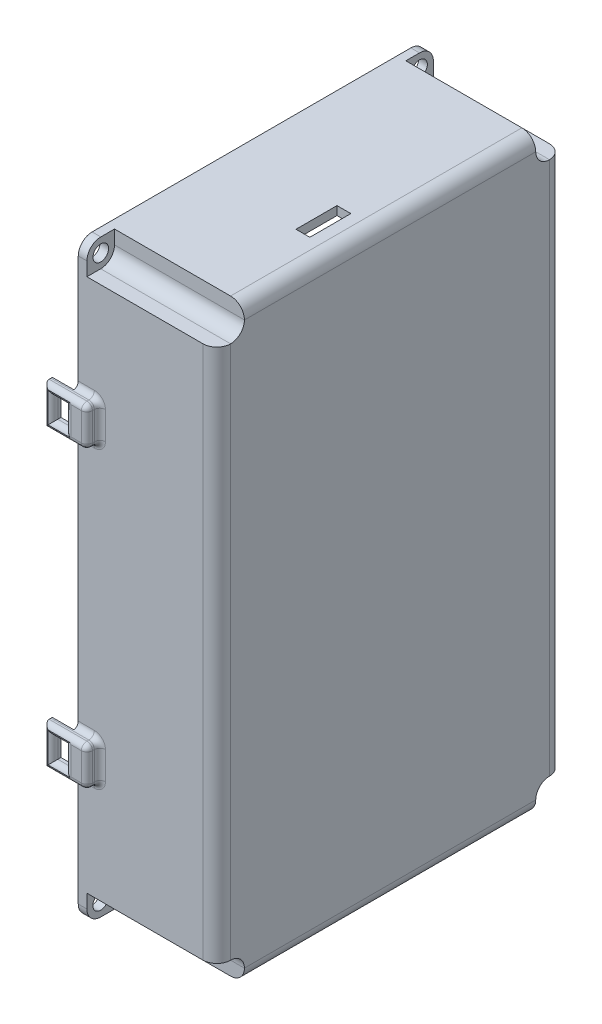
SolidWorks part; units mm, degrees
ref_plane "Front Plane" through (0, 0, 0) normal (0, 0, 1) x (1, 0, 0)
ref_plane "Top Plane" through (0, 0, 0) normal (0, 1, 0) x (1, 0, 0)
ref_plane "Right Plane" through (0, 0, 0) normal (1, 0, 0) x (0, 0, -1)
sketch "Sketch1" plane through (0, 0, 0) normal (1, 0, 0) x (0, 0, -1)
  line L1 (-31.75, -53.975) -> (31.75, -53.975)
  line L2 (-31.75, -53.975) -> (-31.75, 53.975)
  line L3 (-31.75, 53.975) -> (31.75, 53.975)
  line L4 (31.75, -53.975) -> (31.75, 53.975)
  line L5 (-31.75, -53.975) -> (31.75, 53.975) construction
  line L6 (-31.75, 53.975) -> (31.75, -53.975) construction
  point P0 (0, 0)
  dimension "D1" = 63.5
  dimension "D2" = 107.95
extrude "Boss-Extrude1" add sketch "Sketch1" along normal mid plane 25.4
shell "Shell1" thickness 1.5875
sketch "Sketch2" plane through (0, 0, 31.75) normal (0, 0, 1) x (1, 0, 0)
  line L0 (-12.7, 53.975) -> (-12.7, -53.975) construction
  line L1 (-16.6688, 23.4156) -> (-8.7313, 23.4156)
  line L2 (-16.6688, 23.4156) -> (-16.6688, 30.5594)
  line L3 (-16.6688, 30.5594) -> (-8.7313, 30.5594)
  line L4 (-8.7313, 23.4156) -> (-8.7313, 30.5594)
  line L5 (-16.6688, 23.4156) -> (-8.7313, 30.5594) construction
  line L6 (-16.6688, 30.5594) -> (-8.7313, 23.4156) construction
  line L7 (-12.7, 0) -> (12.7, 0) construction
  line L8 (12.7, 53.975) -> (12.7, -53.975) construction
  line L9 (-12.7, 53.975) -> (-12.7, 0) construction
  line L11 (-12.7, 25.0031) -> (-15.0813, 25.0031)
  line L12 (-12.7, 25.0031) -> (-12.7, 28.9719)
  line L13 (-12.7, 28.9719) -> (-15.0813, 28.9719)
  line L14 (-15.0813, 25.0031) -> (-15.0813, 28.9719)
  line L15 (-12.7, 25.0031) -> (-15.0813, 28.9719) construction
  line L16 (-12.7, 28.9719) -> (-15.0813, 25.0031) construction
  point P0 (-12.7, 26.9875)
  point P14 (-12.7, 26.9875)
  point P15 (-16.6688, 26.9875)
  point P16 (-13.8906, 26.9875)
  dimension "D1" = 7.1437
  dimension "D2" = 3.9688
  dimension "D3" = 1.5875
  dimension "D4" = 1.5875
extrude "Boss-Extrude2" add sketch "Sketch2" along normal blind 2.3812
mirror "Mirror1" about plane through (0, 0, 0) normal (0, 1, 0) of "Boss-Extrude2"
mirror "Mirror2" about plane through (0, 0, 0) normal (0, 0, 1) of "Mirror1", "Boss-Extrude2"
sketch "Sketch3" plane through (0, -53.975, 0) normal (0, -1, 0) x (1, 0, 0)
  line L0 (-12.7, 31.75) -> (-12.7, -31.75) construction
  line L1 (-12.7, 15.875) -> (-2.6605, 15.875)
  line L2 (-12.7, 15.875) -> (-12.7, -15.875)
  line L3 (-12.7, -15.875) -> (-2.6605, -15.875)
  line L4 (-2.6605, 15.875) -> (-2.6605, -15.875)
  point P6 (-2.6605, 0)
  dimension "D1" = 31.75
extrude "Cut-Extrude1" cut sketch "Sketch3" against normal blind 3.175
sketch "Sketch4" plane through (-16.6688, 0, 0) normal (-1, 0, 0) x (0, 0, 1)
  line L0 (34.1313, 23.4156) -> (31.75, 23.4156) construction
  line L1 (31.75, 30.5594) -> (32.5438, 30.5594)
  line L2 (31.75, 30.5594) -> (31.75, 23.4156)
  line L3 (31.75, 23.4156) -> (32.5438, 23.4156)
  line L4 (32.5438, 30.5594) -> (32.5438, 23.4156)
  dimension "D1" = 0.7937
extrude "Cut-Extrude2" cut sketch "Sketch4" against normal up to surface (3.9688 mm away)
mirror "Mirror3" about plane through (0, 0, 0) normal (0, 0, 1) of "Cut-Extrude2"
mirror "Mirror4" about plane through (0, 0, 0) normal (0, 1, 0) of "Mirror3", "Cut-Extrude2"
fillet "Fillet1" radius 2.54 7 edges at (12.7, -53.975, 0) (12.7, 0, 31.75) (12.7, 53.975, 0) (12.7, 0, -31.75) (-7.6803, -53.975, -15.875) (-7.6803, -53.975, 15.875) (-2.6605, -53.975, 0)
fillet "Fillet4" radius 1.016 52 edges at (-10.7156, 23.4156, 31.75) (-10.7156, 30.5594, 31.75) (-10.7156, -30.5594, 31.75) (-10.7156, -23.4156, 31.75) (-10.7156, -23.4156, -31.75) (-10.7156, -30.5594, -31.75) (-10.7156, 30.5594, -31.75) (-10.7156, 23.4156, -31.75) (-13.8906, 25.0031, 34.1313) (-12.7, 26.9875, 34.1313) (-13.8906, 28.9719, 34.1313) (-15.0813, 26.9875, 34.1313) (-12.7, 23.4156, 34.1313) (-16.6688, 26.9875, 34.1313) (-12.7, 30.5594, 34.1313) (-8.7313, 23.4156, 32.9406) (-8.7313, 26.9875, 34.1313) (-8.7313, 30.5594, 32.9406) (-8.7313, 26.9875, 31.75) (-12.7, -30.5594, 34.1313) (-16.6688, -26.9875, 34.1313) (-12.7, -23.4156, 34.1313) (-15.0813, -26.9875, 34.1313) (-12.7, -26.9875, 34.1313) (-13.8906, -25.0031, 34.1313) (-13.8906, -28.9719, 34.1313) (-8.7313, -30.5594, 32.9406) (-8.7313, -26.9875, 34.1313) (-8.7313, -23.4156, 32.9406) (-8.7313, -26.9875, 31.75) (-13.8906, -25.0031, -34.1313) (-15.0813, -26.9875, -34.1313) (-12.7, -26.9875, -34.1313) (-13.8906, -28.9719, -34.1313) (-12.7, -23.4156, -34.1313) (-16.6688, -26.9875, -34.1313) (-12.7, -30.5594, -34.1313) (-8.7313, -23.4156, -32.9406) (-8.7313, -26.9875, -34.1313) (-8.7313, -30.5594, -32.9406) (-8.7313, -26.9875, -31.75) (-12.7, 30.5594, -34.1313) (-16.6688, 26.9875, -34.1313) (-12.7, 23.4156, -34.1313) (-15.0813, 26.9875, -34.1313) (-12.7, 26.9875, -34.1313) (-13.8906, 25.0031, -34.1313) (-13.8906, 28.9719, -34.1313) (-8.7313, 30.5594, -32.9406) (-8.7313, 26.9875, -34.1313) (-8.7313, 23.4156, -32.9406) (-8.7313, 26.9875, -31.75)
sketch "Sketch7" plane through (11.1125, 0, 0) normal (-1, 0, 0) x (0, 0, 1)
  line L1 (-30.1625, 52.3875) -> (30.1625, 52.3875) construction
  line L2 (-30.1625, -52.3875) -> (-30.1625, 52.3875) construction
  circle A0 centre (-13.5636, 46.0375) radius 2.3812
  circle A1 centre (13.5636, 46.0375) radius 2.3812
  circle A2 centre (-13.5636, 46.0375) radius 1.4351
  circle A3 centre (13.5636, 46.0375) radius 1.4351
  dimension "D1" = 4.7625
  dimension "D6" = 2.8702
  dimension "D2" = 6.35
  dimension "D3" = 16.5989
  dimension "D4" = 43.7261
  dimension "D5" = 6.35
extrude "Boss-Extrude4" add sketch "Sketch7" along normal blind 5.588
sketch "Sketch8" plane through (0, 53.975, 0) normal (0, 1, 0) x (1, 0, 0)
  line L1 (5.5626, -2.5908) -> (8.1026, -2.5908)
  line L2 (5.5626, -2.5908) -> (5.5626, -10.1092)
  line L3 (5.5626, -10.1092) -> (8.1026, -10.1092)
  line L4 (8.1026, -2.5908) -> (8.1026, -10.1092)
  line L5 (8.1026, -10.1092) -> (5.5626, -2.5908) construction
  line L6 (5.5626, -10.1092) -> (8.1026, -2.5908) construction
  line L10 (10.16, -31.75) -> (10.16, 31.75) construction
  line L11 (10.16, 31.75) -> (-12.7, 31.75) construction
  point P0 (6.8326, -6.35)
  point P5 (0, 0)
  dimension "D1" = 7.5184
  dimension "D2" = 2.54
  dimension "D3" = 38.1
  dimension "D4" = 3.3274
extrude "Cut-Extrude3" cut sketch "Sketch8" against normal blind 5.08
sketch "Sketch9" plane through (11.1125, 0, 0) normal (-1, 0, 0) x (0, 0, 1)
  line L0 (25.8636, -40.9575) -> (27.4511, -40.9575)
  line L1 (25.8636, 4.7625) -> (27.4511, 4.7625)
  line L2 (25.8636, 4.7625) -> (25.8636, 1.5875)
  line L3 (25.8636, 1.5875) -> (27.4511, 1.5875)
  line L4 (27.4511, 4.7625) -> (27.4511, 1.5875)
  line L5 (25.8636, 4.7625) -> (27.4511, 1.5875) construction
  line L6 (25.8636, 1.5875) -> (27.4511, 4.7625) construction
  line L11 (25.8636, -40.9575) -> (25.8636, -44.1325)
  line L12 (25.8636, -44.1325) -> (27.4511, -44.1325)
  line L17 (27.4511, -40.9575) -> (27.4511, -44.1325)
  line L18 (25.8636, -40.9575) -> (27.4511, -44.1325) construction
  line L23 (25.8636, -44.1325) -> (27.4511, -40.9575) construction
  line L24 (-27.451, -40.9575) -> (-25.8635, -40.9575)
  line L25 (-27.451, -40.9575) -> (-27.451, -44.1325)
  line L26 (-27.451, -44.1325) -> (-25.8635, -44.1325)
  line L27 (-25.8635, -40.9575) -> (-25.8635, -44.1325)
  line L28 (-27.451, -40.9575) -> (-25.8635, -44.1325) construction
  line L29 (-27.451, -44.1325) -> (-25.8635, -40.9575) construction
  line L30 (-27.4511, 4.7625) -> (-25.8636, 4.7625)
  line L31 (-27.4511, 4.7625) -> (-27.4511, 1.5875)
  line L32 (-27.4511, 1.5875) -> (-25.8636, 1.5875)
  line L33 (-25.8636, 4.7625) -> (-25.8636, 1.5875)
  line L34 (-27.4511, 4.7625) -> (-25.8636, 1.5875) construction
  line L35 (-27.4511, 1.5875) -> (-25.8636, 4.7625) construction
  line L36 (25.8636, -18.0975) -> (27.4511, -18.0975)
  line L37 (25.8636, -18.0975) -> (25.8636, -21.2725)
  line L38 (25.8636, -21.2725) -> (27.4511, -21.2725)
  line L39 (27.4511, -18.0975) -> (27.4511, -21.2725)
  line L40 (25.8636, -18.0975) -> (27.4511, -21.2725) construction
  line L41 (25.8636, -21.2725) -> (27.4511, -18.0975) construction
  line L42 (-27.4511, -18.0975) -> (-25.8636, -18.0975)
  line L43 (-27.4511, -18.0975) -> (-27.4511, -21.2725)
  line L44 (-27.4511, -21.2725) -> (-25.8636, -21.2725)
  line L45 (-25.8636, -18.0975) -> (-25.8636, -21.2725)
  line L46 (-27.4511, -18.0975) -> (-25.8636, -21.2725) construction
  line L47 (-27.4511, -21.2725) -> (-25.8636, -18.0975) construction
  line L48 (26.6573, 3.175) -> (-26.6573, 3.175) construction
  line L54 (-30.1625, -52.3875) -> (-30.1625, 52.3875) construction
  line L55 (-30.1625, 52.3875) -> (30.1625, 52.3875) construction
  point P0 (26.6573, 3.175)
  point P6 (26.6573, -42.545)
  point P11 (-26.6573, -42.545)
  point P16 (-26.6573, 3.175)
  point P21 (26.6573, -19.685)
  point P26 (-26.6573, -19.685)
  point P32 (0, 3.175)
  point P33 (0, 0)
  dimension "D1" = 3.175
  dimension "D2" = 1.5875
  dimension "D3" = 53.3146
  dimension "D4" = 22.86
  dimension "D5" = 22.86
  dimension "D6" = 30.1625
  dimension "D7" = 49.2125
extrude "Boss-Extrude5" add sketch "Sketch9" along normal blind 8.1216
sketch "Sketch10" plane through (0, 0, 25.8636) normal (0, 0, -1) x (-1, 0, 0)
  line L1 (-2.9908, -18.0975) -> (-4.5784, -18.0975)
  line L2 (-2.9908, -18.0975) -> (-2.9908, -21.2725)
  line L3 (-2.9908, -21.2725) -> (-4.5784, -21.2725)
  line L4 (-4.5784, -18.0975) -> (-4.5784, -21.2725)
  point P5 (7.2438, -4.8779)
  point P6 (-2.9908, -24.4475)
  point P7 (-2.9908, -21.2725)
  dimension "D1" = 1.5875
extrude "Boss-Extrude6" add sketch "Sketch10" along normal blind 1.5875
ref_plane "Plane1" through (0, -8.255, 0) normal (0, 1, 0) x (1, 0, 0)
ref_plane "Plane2" through (0, -31.115, 0) normal (0, -1, 0) x (-1, 0, 0)
mirror "Mirror5" about plane through (0, -8.255, 0) normal (0, 1, 0) of "Boss-Extrude6"
mirror "Mirror6" about plane through (0, -31.115, 0) normal (0, -1, 0) of "Mirror5"
mirror "Mirror7" about plane through (0, 0, 0) normal (0, 0, 1) of "Mirror6", "Boss-Extrude6", "Mirror5"
fillet "Fillet6" radius 1.5875 6 edges at (2.9908, 3.175, -24.2761) (2.9908, -19.685, -24.2761) (2.9908, -42.545, -24.2761) (2.9908, -42.545, 24.2761) (2.9908, -19.685, 24.2761) (2.9908, 3.175, 24.2761)
fillet "Fillet7" radius 1.5875 18 edges at (11.1125, 1.5875, -26.6573) (11.1125, 3.175, -27.4511) (11.1125, 4.7625, -26.6573) (11.1125, 4.7625, 26.6573) (11.1125, 1.5875, 26.6573) (11.1125, -21.2725, 26.6573) (11.1125, -18.0975, 26.6573) (11.1125, -40.9575, 26.6573) (11.1125, -44.1325, 26.6573) (11.1125, -44.1325, -26.6573) (11.1125, -40.9575, -26.6573) (11.1125, -21.2725, -26.6573) (11.1125, -18.0975, -26.6573) (11.1125, -19.685, -27.4511) (11.1125, -42.545, -27.451) (11.1125, -42.545, 27.4511) (11.1125, -19.685, 27.4511) (11.1125, 3.175, 27.4511)
sketch "Sketch13" plane through (-12.7, 0, 0) normal (-1, 0, 0) x (0, 0, 1)
  line L0 (-31.75, 53.975) -> (31.75, 53.975) construction
  line L1 (31.75, 53.975) -> (31.75, 31.5754) construction
  line L2 (-31.75, 31.5754) -> (-31.75, 53.975) construction
  line L5 (-31.75, -53.975) -> (-31.75, -31.5754) construction
  line L6 (-18.2296, -53.975) -> (-31.75, -53.975) construction
  line L7 (31.75, -31.5754) -> (31.75, -53.975) construction
  line L8 (31.75, -53.975) -> (18.2296, -53.975) construction
  circle A0 centre (28.429, 50.6539) radius 3.3211
  circle A1 centre (-28.429, 50.6539) radius 3.3211
  circle A2 centre (-28.429, -50.6539) radius 3.3211
  circle A3 centre (28.429, -50.6539) radius 3.3211
  point P8 (23.6891, 46.4053)
  point P17 (-12.2369, -32.5298)
  point P20 (12.2822, -34.3326)
  dimension "D1" = 6.6421
extrude "Boss-Extrude7" add sketch "Sketch13" against normal up to surface (23.8125 mm away)
sketch "Sketch14" plane through (12.7, 0, 0) normal (1, 0, 0) x (0, 0, -1)
  line L0 (26.6954, -51.4477) -> (26.6954, -53.975)
  line L1 (31.75, 50.6539) -> (31.75, -50.6539) construction
  line L2 (-28.429, 53.975) -> (28.429, 53.975) construction
  line L3 (-31.75, -50.6539) -> (-31.75, 50.6539) construction
  line L4 (28.429, -53.975) -> (-28.429, -53.975) construction
  line L13 (-26.6954, 51.4477) -> (-26.6954, 53.975)
  line L14 (-26.6954, 53.975) -> (-31.75, 53.975)
  line L15 (-31.75, 53.975) -> (-31.75, 48.9204)
  line L16 (-31.75, 48.9204) -> (-29.2227, 48.9204)
  line L17 (26.6954, 51.4477) -> (26.6954, 53.975)
  line L18 (26.6954, 53.975) -> (31.75, 53.975)
  line L19 (31.75, 53.975) -> (31.75, 48.9204)
  line L20 (31.75, 48.9204) -> (29.2227, 48.9204)
  line L21 (26.6954, -53.975) -> (31.75, -53.975)
  line L22 (31.75, -53.975) -> (31.75, -48.9204)
  line L23 (31.75, -48.9204) -> (29.2227, -48.9204)
  line L24 (-29.2227, -48.9204) -> (-31.75, -48.9204)
  line L25 (-31.75, -48.9204) -> (-31.75, -53.975)
  line L26 (-31.75, -53.975) -> (-26.6954, -53.975)
  line L27 (-26.6954, -53.975) -> (-26.6954, -51.4477)
  arc A0 (26.6954, 51.4477) -> (29.2227, 48.9204) centre (29.2227, 51.4477) ccw
  arc A1 (-29.2227, 48.9204) -> (-26.6954, 51.4477) centre (-29.2227, 51.4477) ccw
  arc A3 (-26.6954, -51.4477) -> (-29.2227, -48.9204) centre (-29.2227, -51.4477) ccw
  arc A4 (29.2227, -48.9204) -> (26.6954, -51.4477) centre (29.2227, -51.4477) ccw
  point P28 (-31.75, -48.9672)
  dimension "D1" = 5.0546
extrude "Cut-Extrude4" cut sketch "Sketch14" against normal offset from surface (23.8125 mm away) 1.5875
fillet "Fillet8" radius 2.54 4 edges at (-11.9062, -53.975, -31.75) (-11.9062, -53.975, 31.75) (-11.9062, 53.975, 31.75) (-11.9062, 53.975, -31.75)
sketch "Sketch15" plane through (-11.1125, 0, 0) normal (1, 0, 0) x (0, 0, -1)
  circle A0 centre (-29.21, 51.435) radius 1.4351
  circle A1 centre (29.21, 51.435) radius 1.4351
  circle A2 centre (29.21, -51.435) radius 1.4351
  circle A3 centre (-29.2227, -51.4477) radius 1.4351
  dimension "D1" = 2.8702
extrude "Cut-Extrude5" cut sketch "Sketch15" against normal through all
sketch "Sketch16" plane through (11.1125, 0, 0) normal (-1, 0, 0) x (0, 0, 1)
  line L0 (-30.1625, -47.8213) -> (-30.1625, 47.8213) construction
  line L1 (-25.5963, 52.3875) -> (25.5963, 52.3875) construction
  line L2 (30.1625, 47.8213) -> (30.1625, -47.8213) construction
  line L3 (-18.2296, -53.975) -> (-29.21, -53.975) construction
  circle A0 centre (21.6726, 44.1284) radius 2.7813
  circle A1 centre (-21.6726, 44.1284) radius 2.7813
  circle A2 centre (21.6726, -47.6354) radius 2.7813
  circle A3 centre (-21.6726, -47.6354) radius 2.7813
  circle A4 centre (-21.6726, 44.1284) radius 1.4351
  circle A5 centre (21.6726, 44.1284) radius 1.4351
  circle A6 centre (21.6726, -47.6354) radius 1.4351
  circle A7 centre (-21.6726, -47.6354) radius 1.4351
  dimension "D1" = 5.5626
  dimension "D6" = 2.8702
  dimension "D2" = 8.49
  dimension "D3" = 8.2591
  dimension "D4" = 8.49
  dimension "D5" = 6.3396
extrude "Boss-Extrude8" add sketch "Sketch16" along normal blind 11.1125
